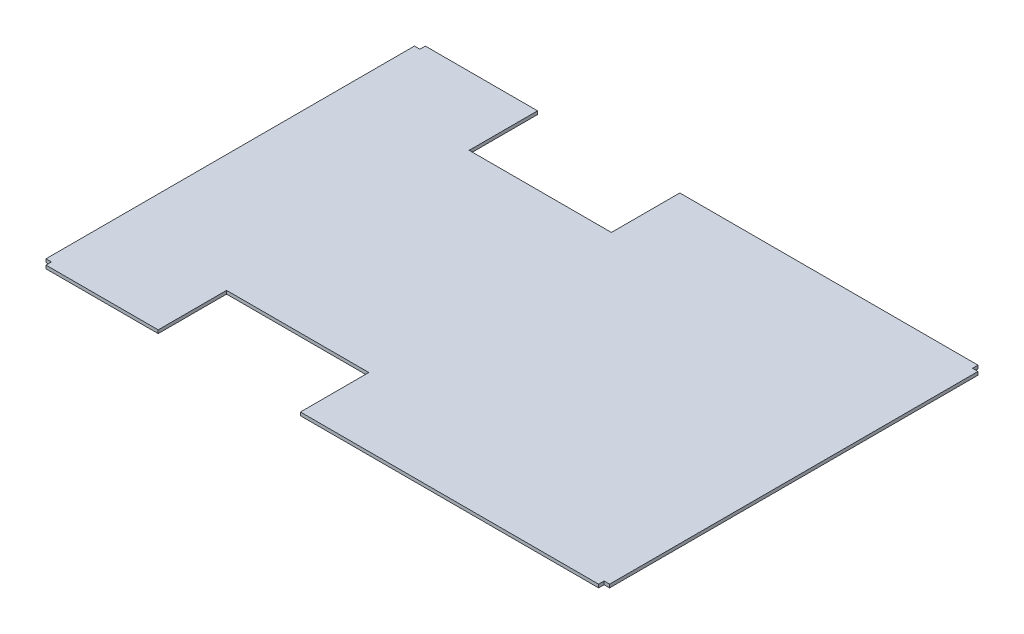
SolidWorks part; units mm, degrees
ref_plane "Plan de face" through (0, 0, 0) normal (0, 0, 1) x (1, 0, 0)
ref_plane "Plan de dessus" through (0, 0, 0) normal (0, 1, 0) x (1, 0, 0)
ref_plane "Plan de droite" through (0, 0, 0) normal (1, 0, 0) x (0, 0, -1)
sketch "Esquisse1" plane through (0, 0, 0) normal (0, 1, 0) x (1, 0, 0)
  line L0 (0, 0) -> (0, 2080)
  line L1 (0, 2080) -> (645, 2080)
  line L2 (645, 2080) -> (645, 1705)
  line L3 (645, 1705) -> (1425, 1705)
  line L4 (1425, 1705) -> (1425, 2080)
  line L5 (1425, 2080) -> (3090, 2080)
  line L6 (3090, 2080) -> (3090, 0)
  line L7 (3090, 0) -> (1425, 0)
  line L8 (1425, 0) -> (1425, 375)
  line L9 (1425, 375) -> (645, 375)
  line L10 (645, 375) -> (645, 0)
  line L11 (645, 0) -> (0, 0)
  dimension "D1" = 2080
  dimension "D2" = 3090
  dimension "D3" = 645
  dimension "D4" = 780
  dimension "D5" = 375
extrude "Boss.-Extru.1" add sketch "Esquisse1" along normal blind 18
sketch "Esquisse3" plane through (0, 0, 0) normal (0, 1, 0) x (1, 0, 0)
  line L1 (0, 2080) -> (30, 2080)
  line L2 (0, 2080) -> (0, 2050)
  line L3 (0, 2050) -> (30, 2050)
  line L4 (30, 2080) -> (30, 2050)
  line L5 (3090, 2080) -> (3060, 2080)
  line L6 (3090, 2080) -> (3090, 2050)
  line L7 (3090, 2050) -> (3060, 2050)
  line L8 (3060, 2080) -> (3060, 2050)
  line L9 (3090, 0) -> (3060, 0)
  line L10 (3090, 0) -> (3090, 30)
  line L11 (3090, 30) -> (3060, 30)
  line L12 (3060, 0) -> (3060, 30)
  line L13 (0, 0) -> (30, 0)
  line L14 (0, 0) -> (0, 30)
  line L15 (0, 30) -> (30, 30)
  line L16 (30, 0) -> (30, 30)
  dimension "D1" = 30
  dimension "D2" = 30
  dimension "D3" = 30
  dimension "D4" = 30
  dimension "D5" = 30
  dimension "D6" = 30
  dimension "D7" = 30
  dimension "D8" = 30
extrude "Enlèv. mat.-Extru.3" cut sketch "Esquisse3" along normal through all
